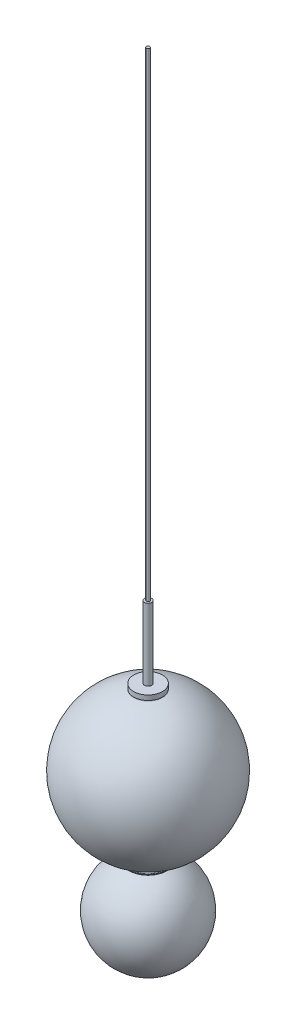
SolidWorks part; units mm, degrees
ref_plane "Alzado" through (0, 0, 0) normal (0, 0, 1) x (1, 0, 0)
ref_plane "Planta" through (0, 0, 0) normal (0, 1, 0) x (1, 0, 0)
ref_plane "Vista lateral" through (0, 0, 0) normal (1, 0, 0) x (0, 0, -1)
sketch "Croquis1" plane through (0, 0, 0) normal (0, 0, 1) x (1, 0, 0)
  line L0 (0, 0) -> (0, -184.2662) construction
  line L6 (0, 146.9694) -> (0, -146.9694) construction
  line L8 (0, -184.2662) -> (0, -352.6403) construction
  line L9 (0, -184.2662) -> (0, -435.8689) construction
  line L10 (0, 146.9694) -> (30, 146.9694)
  line L11 (0, 147.9694) -> (30, 147.9694)
  line L12 (0, 147.9694) -> (0, 157.9694)
  line L13 (0, 157.9694) -> (30, 157.9694)
  line L14 (30, 147.9694) -> (30, 157.9694)
  line L15 (0, 143.9694) -> (29.6954, 143.9694)
  line L16 (0, 146.9694) -> (0, 143.9694)
  line L17 (20, -148.6607) -> (20, -145.6331)
  line L18 (20, -154.6607) -> (20, -157.7245)
  line L19 (0, -349.6403) -> (0, -352.6403)
  line L20 (20, -147.1469) -> (0, -147.1469) construction
  line L21 (20, -156.1926) -> (0, -156.1926) construction
  arc A0 (20, -148.6607) -> (30, 146.9694) centre (0, 0) ccw
  arc A1 (0, -352.6403) -> (20, -154.6607) centre (0, -252.6403) ccw
  arc A2 (20, -145.6331) -> (29.6954, 143.9694) centre (0, 0) ccw
  arc A3 (19.6, -145.6875) -> (29.6954, 143.9694) centre (0, 0) ccw construction
  arc A4 (0, -349.6403) -> (20, -157.7245) centre (0, -252.6403) ccw
  arc A5 (0, -349.6403) -> (19.4, -157.6001) centre (0, -252.6403) ccw construction
  arc A6 (0, -352.6403) -> (20, -154.6607) centre (0, -252.6403) ccw construction
  dimension "D1" = 300
  dimension "D2" = 200
  dimension "D3" = 3
  dimension "D4" = 3
  dimension "D5" = 20
  dimension "D6" = 20
  dimension "D7" = 6
  dimension "D9" = 30
  dimension "D10" = 10
  dimension "D11" = 30
  dimension "D12" = 1
revolve "Revolución1" add sketch "Croquis1" angle 360 about L9
sketch "Croquis3" plane through (0, 157.9694, 0) normal (0, 1, 0) x (1, 0, 0)
  circle A0 centre (0, 0) radius 7.5
  circle A1 centre (0, 0) radius 30 construction
  dimension "D1" = 15
extrude "Saliente-Extruir1" add sketch "Croquis3" along normal blind 150
sketch "Croquis4" plane through (0, 307.9694, 0) normal (0, 1, 0) x (1, 0, 0)
  circle A0 centre (0, 0) radius 3.5
  dimension "D1" = 7
extrude "Saliente-Extruir2" add sketch "Croquis4" along normal blind 1000 separate body
sketch "Croquis5" plane through (0, 0, 0) normal (0, 0, 1) x (1, 0, 0)
  line L0 (0, 0) -> (0, -397.4594) construction
  line L1 (40, -144.5683) -> (40, -146.6424)
  line L2 (40, -158.8106) -> (40, -160.9888)
  line L3 (20, -148.6607) -> (20, -140.9304)
  line L4 (20, -140.9304) -> (18, -140.9304)
  line L5 (18, -140.9304) -> (18, -150.9304)
  line L6 (20, -154.6607) -> (20, -162.2411)
  line L7 (20, -162.2411) -> (18, -162.2411)
  line L8 (18, -162.2411) -> (18, -152.2411)
  arc A0 (20, -148.6607) -> (30, 146.9694) centre (0, 0) ccw construction
  arc A2 (20, -148.6607) -> (40, -144.5683) centre (0, 0) ccw
  arc A3 (-20, -154.6607) -> (20, -154.6607) centre (0, -252.6403) ccw construction
  arc A4 (18, -150.9304) -> (40, -146.6424) centre (0, 0) ccw
  arc A6 (20.2667, -150.6428) -> (30.4, 148.929) centre (0, 0) ccw construction
  arc A7 (20, -148.6607) -> (30, 146.9694) centre (0, 0) ccw construction
  arc A9 (40, -160.9888) -> (20, -154.6607) centre (0, -252.6403) ccw
  arc A11 (40, -158.8106) -> (18, -152.2411) centre (0, -252.6403) ccw
  point P17 (0, 0)
  dimension "D7" = 2
  dimension "D10" = 2
  dimension "D2" = 2
  dimension "D3" = 40
  dimension "D4" = 18
  dimension "D5" = 10
  dimension "D6" = 40
  dimension "D8" = 10
  dimension "D9" = 18
  dimension "D1" = 2
revolve "Revolución2" add sketch "Croquis5" angle 360 about L0
sketch "Croquis7" plane through (0, 0, 0) normal (0, 0, 1) x (1, 0, 0)
  line L6 (0, 0) -> (0, -461.3272) construction
  line L13 (18, -140.9304) -> (-18, -140.9304) construction
  line L14 (-18, -140.9304) -> (0, -140.9304)
  line L15 (-18, -140.9304) -> (-18, -162.2411)
  line L16 (-18, -162.2411) -> (-10, -162.2411)
  line L17 (0, -140.9304) -> (0, -162.2411)
  line L18 (-18, -162.2411) -> (18, -162.2411) construction
  line L21 (-10, -162.2411) -> (-10, -177.2411)
  line L22 (-10, -177.2411) -> (0, -177.2411)
  line L23 (0, -162.2411) -> (0, -177.2411)
  dimension "D1" = 15
  dimension "D2" = 10
revolve "Revolución3" add sketch "Croquis7" angle 360 about L6
thread "Rosca1" pitch 2 start angle 0, offset 0, length 0, pitch 2, diameter 36
ref_plane "Plano2" through (18, -162.2411, 0) normal (0, 0, 1) x (1, 0, 0)
sketch "Perfil de rosca2" plane through (18, -162.2411, 0) normal (0, 0, 1) x (1, 0, 0)
  line L0 (0, 0) -> (0, 2) construction
  line L1 (0, 0) -> (1.0825, 0.625)
  line L2 (1.0825, 0.625) -> (1.0825, 0.875)
  line L3 (1.0825, 0.875) -> (0, 1.5)
  line L4 (1.0825, 0.75) -> (0, 0.75) construction
  line L11 (0, 0) -> (0, 1.5)
  point P2 (0, 0)
  dimension "Pitch" = 2
  dimension "Profile_Angle" = 60
  dimension "Profile_Land" = 0.25
  dimension "Profile_Height" = 1.0825
thread "Rosca2" pitch 2 start angle 0, offset 0, length 0, pitch 2, diameter 36
ref_plane "Plano3" through (-18, -152.2411, 0) normal (0, 0, 1) x (-1, 0, 0)
sketch "Perfil de rosca3" plane through (-18, -152.2411, 0) normal (0, 0, 1) x (-1, 0, 0)
  line L0 (0, 0) -> (0, 2) construction
  line L1 (0, 0) -> (1.0825, 0.625)
  line L2 (1.0825, 0.625) -> (1.0825, 0.875)
  line L3 (1.0825, 0.875) -> (0, 1.5)
  line L4 (1.0825, 0.75) -> (0, 0.75) construction
  line L11 (0, 0) -> (0, 1.5)
  point P2 (0, 0)
  dimension "Pitch" = 2
  dimension "Profile_Angle" = 60
  dimension "Profile_Land" = 0.25
  dimension "Profile_Height" = 1.0825
sketch "Croquis15" plane through (0, 0, 0) normal (0, 0, 1) x (1, 0, 0)
  line L0 (0, -140.9304) -> (0, -238.1368) construction
  line L1 (20, -140.9304) -> (-20, -140.9304) construction
  line L2 (0, -177.2411) -> (-10, -177.2411)
  line L3 (0, -177.2411) -> (0, -223.2411)
  line L5 (-10, -177.2411) -> (10, -177.2411) construction
  arc A0 (-12.2842, -180.7963) -> (0, -223.2411) centre (0, -200.2411) ccw
  arc A1 (-12.2842, -180.7963) -> (-10, -177.2411) centre (-14.9547, -176.5692) ccw
  point P11 (-10, -177.2411)
  point P12 (-12.2842, -180.7963)
  dimension "D1" = 23
  dimension "D2" = 5
revolve "Revolución4" add sketch "Croquis15" angle 360 about L0
fillet "Redondeo1" radius 1 1 edges at (0, -146.6424, 40)
fillet "Redondeo2" radius 1 1 edges at (0, -158.8106, 40)
